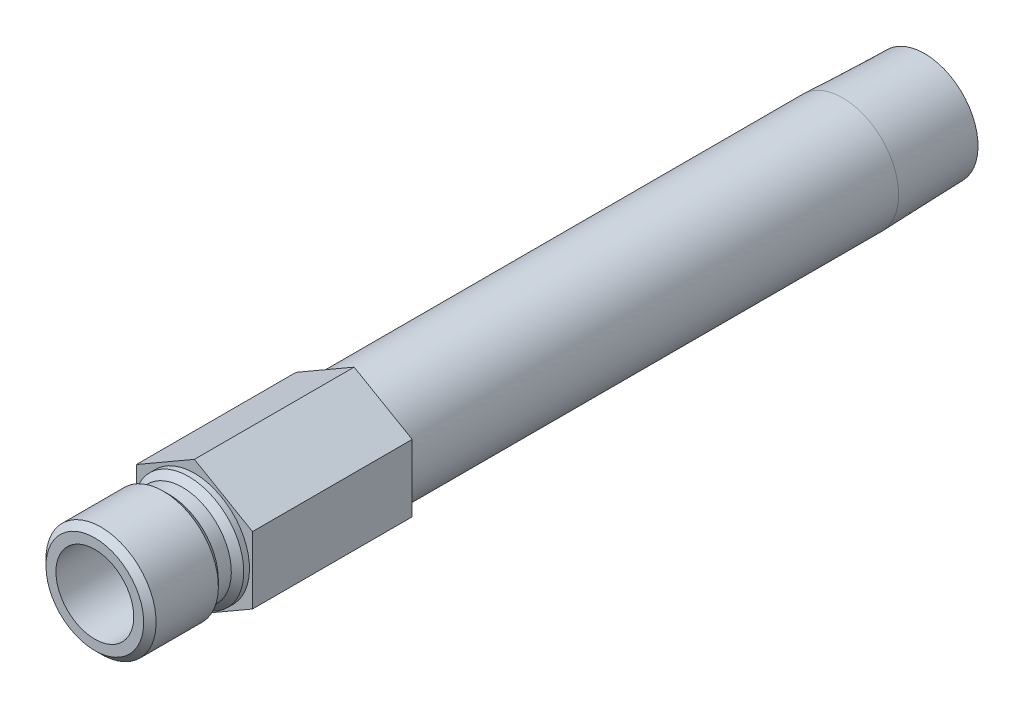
SolidWorks part; units mm, degrees
ref_plane "Front Plane" through (0, 0, 0) normal (0, 0, 1) x (1, 0, 0)
ref_plane "Top Plane" through (0, 0, 0) normal (0, 1, 0) x (1, 0, 0)
ref_plane "Right Plane" through (0, 0, 0) normal (1, 0, 0) x (0, 0, -1)
sketch "Sketch1" plane through (0, 0, 0) normal (1, 0, 0) x (0, 0, -1)
  line L0 (0, 0) -> (-15.367, 0) construction
  line L1 (-12.192, 4.7625) -> (-12.192, 5.9817)
  line L2 (-3.048, 5.9817) -> (-3.048, 0) construction
  line L3 (-11.43, 6.7437) -> (-3.81, 6.7437)
  line L4 (0, 6.858) -> (0, 4.7625) construction
  line L5 (-3.048, 5.9817) -> (-1.4605, 5.9817)
  line L6 (-0.6985, 6.7437) -> (0, 6.7437)
  line L7 (0, 6.7437) -> (0, 6.858)
  line L8 (-3.048, 5.9817) -> (-3.81, 6.7437)
  line L9 (-1.4605, 5.9817) -> (-0.6985, 6.7437)
  line L10 (-12.192, 5.9817) -> (-11.43, 6.7437)
  line L11 (-12.192, 4.7625) -> (0, 4.7625)
  line L12 (0, 6.858) -> (79.375, 6.858)
  line L13 (79.375, 6.858) -> (89.408, 6.5445)
  line L14 (89.408, 6.5445) -> (89.408, 4.6228)
  line L15 (0, 6.7437) -> (19.558, 6.7437) construction
  line L16 (19.558, 6.7437) -> (19.558, 0) construction
  line L17 (19.558, 0) -> (0, 0) construction
  line L19 (0.0743, 4.6228) -> (89.408, 4.6228)
  line L20 (0, 4.7625) -> (0.0743, 4.6228)
  line L21 (0, 4.6272) -> (0, 0) construction
  dimension "D2" = 1.5875
  dimension "D3" = 0.762
  dimension "D4" = 45
  dimension "D5" = 9.144
  dimension "D6" = 45
  dimension "D7" = 1.79
  dimension "D8" = 10.033
  dimension "D9" = 101.6
  dimension "D10" = 3.175
  dimension "D11" = 9.525
  dimension "D12" = 13.716
  dimension "D13" = 31.75
  dimension "D14" = 13.4874
  dimension "D15" = 9.2456
  dimension "D16" = 19.558
  dimension "D17" = 118
  dimension "D18" = 12.192
revolve "Revolve1" add sketch "Sketch1" angle 360 about L0
sketch "Sketch2" plane through (0, 0, 0) normal (0, 0, 1) x (1, 0, 0)
  line L1 (-7.112, 4.1061) -> (-7.112, -4.1061)
  line L2 (-7.112, -4.1061) -> (0, -8.2122)
  line L3 (0, -8.2122) -> (7.112, -4.1061)
  line L4 (7.112, -4.1061) -> (7.112, 4.1061)
  line L5 (7.112, 4.1061) -> (0, 8.2122)
  line L6 (0, 8.2122) -> (-7.112, 4.1061)
  circle A0 centre (0, 0) radius 7.112 construction
  circle A1 centre (0, 0) radius 4.6228 construction
  circle A2 centre (0, 0) radius 4.6228
  dimension "D1" = 14.224
extrude "Boss-Extrude1" add sketch "Sketch2" against normal up to vertex (19.558 mm away) from vertex at 0
